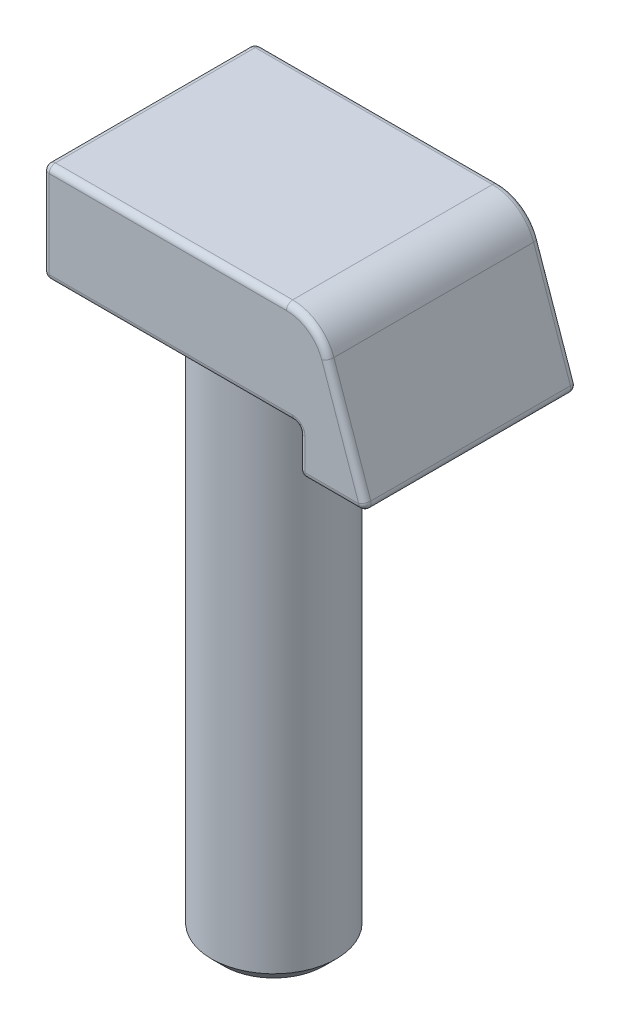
SolidWorks part; units mm, degrees
ref_plane "Face" through (0, 0, 0) normal (0, 0, 1) x (1, 0, 0)
ref_plane "Dessus" through (0, 0, 0) normal (0, 1, 0) x (1, 0, 0)
ref_plane "Droite" through (0, 0, 0) normal (1, 0, 0) x (0, 0, -1)
sketch "Esquisse1" plane through (0, 0, 0) normal (0, 0, 1) x (1, 0, 0)
  line L0 (0.5, 0) -> (20, 0)
  line L1 (0, 0.5) -> (0, 7.5)
  line L2 (0.5, 8) -> (19.5117, 8)
  line L3 (20.5, -0.5) -> (20.5, -3)
  line L4 (21, -3.5) -> (25.2967, -3.5)
  line L5 (25.769, -2.8357) -> (22.8175, 5.6498)
  arc A0 (22.8175, 5.6498) -> (19.5117, 8) centre (19.5117, 4.5) ccw
  arc A1 (20.5, -0.5) -> (20, 0) centre (20, -0.5) ccw
  arc A2 (25.769, -2.8357) -> (25.2967, -3.5) centre (25.2967, -3) cw
  arc A3 (21, -3.5) -> (20.5, -3) centre (21, -3) cw
  arc A4 (0, 7.5) -> (0.5, 8) centre (0.5, 7.5) cw
  arc A5 (0.5, 0) -> (0, 0.5) centre (0.5, 0.5) cw
  point P9 (22, 8)
  point P12 (20.5, 0)
  point P15 (26, -3.5)
  point P18 (20.5, -3.5)
  point P21 (0, 8)
  point P24 (0, 0)
  dimension "D6" = 3.5
  dimension "D7" = 0.5
  dimension "D1" = 20.5
  dimension "D2" = 5.5
  dimension "D3" = 22
  dimension "D4" = 8
  dimension "D5" = 3.5
extrude "Extrusion1" add sketch "Esquisse1" along normal blind 17
fillet "Congé1" radius 0.5
sketch "Esquisse2" plane through (0, 0, 0) normal (0, -1, 0) x (1, 0, 0)
  circle A0 centre (10, 8.5) radius 5
  dimension "D1" = 10
  dimension "D3" = 10
  dimension "D2" = 8.5
extrude "Extrusion2" add sketch "Esquisse2" along normal blind 45
chamfer "Chanfrein1" distance 1 angle 45
